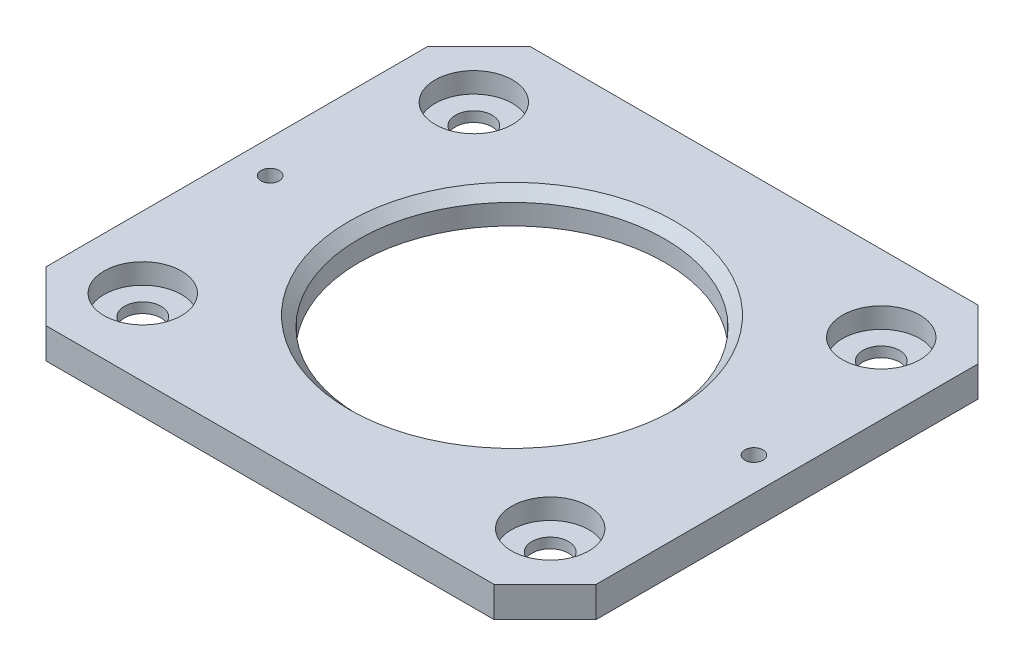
SolidWorks part; units mm, degrees
ref_plane "Front Plane" through (0, 0, 0) normal (0, 0, 1) x (1, 0, 0)
ref_plane "Top Plane" through (0, 0, 0) normal (0, 1, 0) x (1, 0, 0)
ref_plane "Right Plane" through (0, 0, 0) normal (1, 0, 0) x (0, 0, -1)
sketch "Sketch1" plane through (0, 0, 0) normal (0, 1, 0) x (1, 0, 0)
  line L1 (-34.29, -30.1625) -> (34.29, -30.1625)
  line L2 (-34.29, -30.1625) -> (-34.29, 30.1625)
  line L3 (-34.29, 30.1625) -> (34.29, 30.1625)
  line L4 (34.29, -30.1625) -> (34.29, 30.1625)
  line L5 (-34.29, -30.1625) -> (34.29, 30.1625) construction
  line L6 (-34.29, 30.1625) -> (34.29, -30.1625) construction
  point P0 (0, 0)
  dimension "D1" = 60.325
  dimension "D2" = 68.58
extrude "Boss-Extrude1" add sketch "Sketch1" along normal blind 3.81
chamfer "Chamfer1" distance 6.35 angle 45 4 edges at (34.29, 1.905, -30.1625) (34.29, 1.905, 30.1625) (-34.29, 1.905, 30.1625) (-34.29, 1.905, -30.1625)
sketch "Sketch3" plane through (0, 3.81, 0) normal (0, 1, 0) x (1, 0, 0)
  circle A0 centre (0, 0) radius 19.05
  dimension "D1" = 38.1
extrude "Cut-Extrude2" cut sketch "Sketch3" against normal through all both and the other way through all
sketch "Sketch4" plane through (0, 0, 0) normal (0, -1, 0) x (1, 0, 0)
  line L5 (25.4, -20.6375) -> (-25.4, -20.6375) construction
  line L6 (25.4, -20.6375) -> (25.4, 20.6375) construction
  line L7 (25.4, 20.6375) -> (-25.4, 20.6375) construction
  line L8 (-25.4, -20.6375) -> (-25.4, 20.6375) construction
  line L9 (25.4, -20.6375) -> (-25.4, 20.6375) construction
  line L10 (25.4, 20.6375) -> (-25.4, -20.6375) construction
  circle A1 centre (-25.4, 20.6375) radius 2.286
  circle A2 centre (-25.4, -20.6375) radius 2.286
  circle A3 centre (25.4, -20.6375) radius 2.286
  circle A4 centre (25.4, 20.6375) radius 2.286
  point P8 (0, 0)
  dimension "D3" = 4.572
  dimension "D1" = 50.8
  dimension "D2" = 41.275
extrude "Cut-Extrude3" cut sketch "Sketch4" against normal through all both and the other way through all
sketch "Sketch5" plane through (0, 0, 0) normal (0, -1, 0) x (1, 0, 0)
  circle A0 centre (-25.4, 20.6375) radius 4.826
  circle A4 centre (-25.4, -20.6375) radius 4.826
  circle A5 centre (25.4, -20.6375) radius 4.826
  circle A6 centre (25.4, 20.6375) radius 4.826
  dimension "D1" = 9.652
extrude "Cut-Extrude4" cut sketch "Sketch5" against normal up to surface (2.54 mm away) from offset 1.27
sketch "Sketch6" plane through (0, 3.81, 0) normal (0, 1, 0) x (1, 0, 0)
  line L0 (34.29, 0) -> (-34.29, 0) construction
  line L3 (-30.1625, 0) -> (0, 19.05) construction
  line L4 (0, 19.05) -> (30.1625, 0) construction
  line L5 (-34.29, 23.8125) -> (-34.29, -23.8125) construction
  line L6 (34.29, -23.8125) -> (34.29, 23.8125) construction
  circle A0 centre (-30.1625, 0) radius 2.9718
  circle A1 centre (30.1625, 0) radius 2.9718
  circle A3 centre (0, 0) radius 19.05 construction
  dimension "D1" = 60.325
hole_wizard "Tap Drill for #4-40 Tap1" positions "3DSketch1" profile "Sketch8" hole size "#4-40" standard "ANSI Inch"
sketch3d "3DSketch1"
  point P0 (-30.1625, 3.81, 0)
  point P3 (30.1625, 3.81, 0)
sketch "Sketch8" plane through (-30.1625, 3.81, 0) normal (1, 0, 0) x (0, 0, 1)
  line L0 (0, 0) -> (0, 2.54)
  line L1 (0, 2.54) -> (1.1303, 1.8608)
  line L2 (1.1303, 1.8608) -> (1.1303, 0)
  line L5 (1.1303, 0) -> (0, 0)
  line L10 (0, 2.54) -> (-1.1303, 1.8608) construction
  line L11 (0, -6.35) -> (0, 107.95) construction
  dimension "Hole Dia." = 2.2606
  dimension "Hole Depth" = 2.54
  dimension "Drill Angle" = 118
chamfer "Chamfer2" distance 1.27 angle 45 1 edges at (0, 3.81, -19.05)
sketch "Sketch11" plane through (0, 0, 0) normal (0, -1, 0) x (1, 0, 0)
  circle A0 centre (0, 0) radius 23.8633
  circle A1 centre (0, 0) radius 22.0853
  dimension "D1" = 47.7266
  dimension "D2" = 44.1706
extrude "Cut-Extrude5" cut sketch "Sketch11" against normal blind 1.1906
